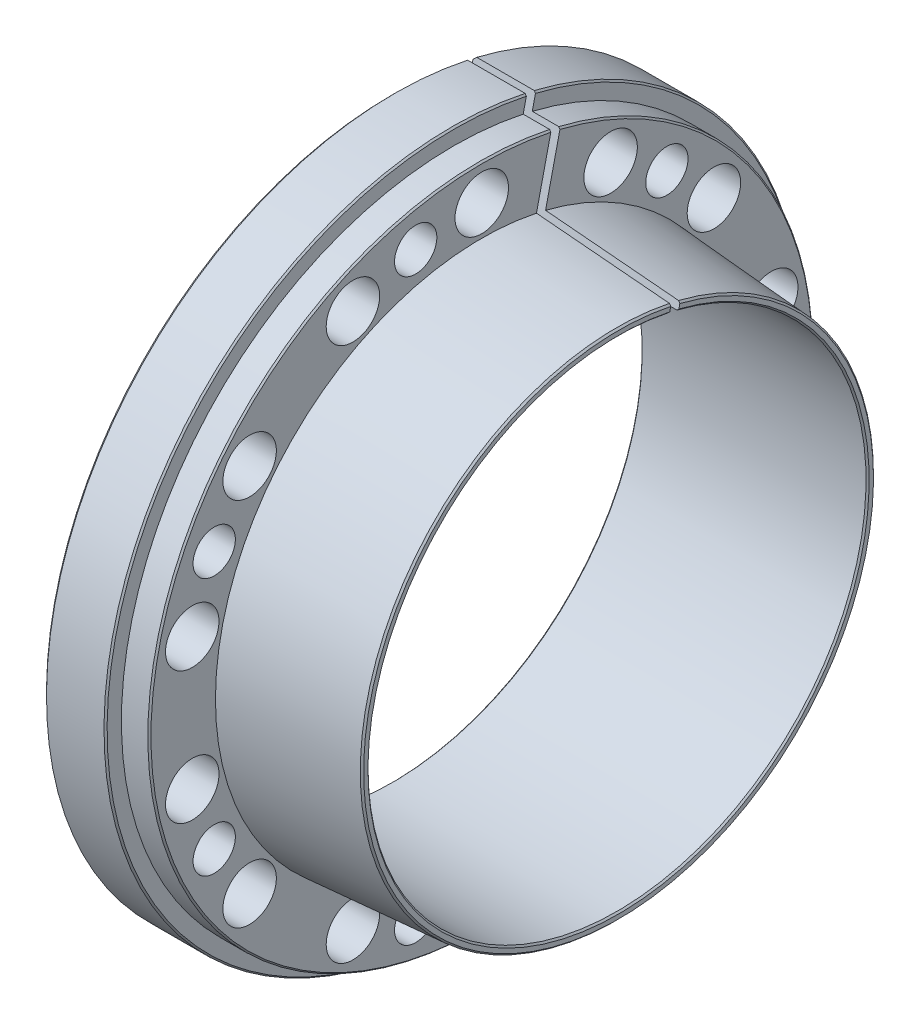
SolidWorks part; units mm, degrees
ref_plane "前视基准面" through (0, 0, 0) normal (0, 0, 1) x (1, 0, 0)
ref_plane "上视基准面" through (0, 0, 0) normal (0, 1, 0) x (1, 0, 0)
ref_plane "右视基准面" through (0, 0, 0) normal (1, 0, 0) x (0, 0, -1)
other "Configuration Table"
sketch "草图1" plane through (0, 0, 0) normal (0, 0, 1) x (1, 0, 0)
  line L0 (0, 0) -> (16.3715, 0) construction
  line L1 (0, 56) -> (10, 56)
  line L2 (10, 56) -> (10, 53.45)
  line L3 (10, 53.45) -> (14.5, 53.45)
  line L4 (14.5, 53.45) -> (14.5, 42.8275)
  line L5 (14.5, 42.8275) -> (36.5, 41.2505)
  line L6 (36.5, 41.2505) -> (36.5, 40.05)
  line L7 (36.5, 40.05) -> (0, 40.05)
  line L8 (0, 40.05) -> (0, 56)
  dimension "D1" = 112
  dimension "D2" = 106.9
  dimension "D3" = 85.655
  dimension "D4" = 4.1
  dimension "D5" = 80.1
  dimension "D6" = 36.5
  dimension "D7" = 10
  dimension "D8" = 4.5
revolve "旋转1" add sketch "草图1" angle 360 about L0
chamfer "倒角1" distance 0.25 angle 45 4 edges at (10, 0, 56) (36.5, 0, 40.05) (36.5, 0, 41.2505) (14.5, 0, 53.45)
chamfer "倒角2" distance 0.25 angle 45 1 edges at (0, 0, 40.05)
chamfer "倒角3" distance 0.5 angle 45 1 edges at (0, 0, 56)
sketch "草图2" plane through (0, 0, 0) normal (-1, 0, 0) x (0, 0, 1)
  circle A0 centre (0, 47.75) radius 4.3
  dimension "D1" = 8.6
  dimension "D2" = 47.75
extrude "切除-拉伸1" cut sketch "草图2" against normal through all
pattern_circular "阵列(圆周)1" count 14 over 360 about axis through (0, 0, 0) along (1, 0, 0) of "切除-拉伸1"
hole_wizard " 螺纹孔1" positions "草图3" profile "草图4" tap size "M8" standard "GB"
sketch "草图3" plane through (0, 0, 0) normal (-1, 0, 0) x (0, 0, 1)
  line L0 (0, 47.75) -> (0, 0) construction
  line L1 (0, 0) -> (10.6253, 46.5528) construction
  point P0 (10.6253, 46.5528)
  dimension "D1" = 47.75
  dimension "D2" = 12.857
sketch "草图4" plane through (0, 46.5528, 10.6253) normal (0, 1, 0) x (0, 0, 1)
  line L0 (0, 0) -> (0, 36.5)
  line L1 (0, 36.5) -> (3.4, 36.5)
  line L2 (3.4, 36.5) -> (3.4, 0)
  line L5 (3.4, 0) -> (0, 0)
  line L11 (0, -6.35) -> (0, 107.95) construction
  dimension "通孔螺纹孔钻头直径" = 6.8
  dimension "通孔螺纹孔钻头深度" = 36.5
pattern_circular "阵列(圆周)2" count 7 over 360 about axis through (0, 0, -0.0001) along (1, 0, 0) of " 螺纹孔1"
sketch "草图5" plane through (0, 0, 0) normal (-1, 0, 0) x (0, 0, 1)
  line L0 (0, 0) -> (-12.4611, 54.596)
  line L1 (0, 0) -> (0, 47.75) construction
  circle A0 centre (0, 0) radius 56 construction
  dimension "D1" = 12.857
extrude "切除-拉伸-薄壁1" cut sketch "草图5" against normal through all and the other way through all thin
